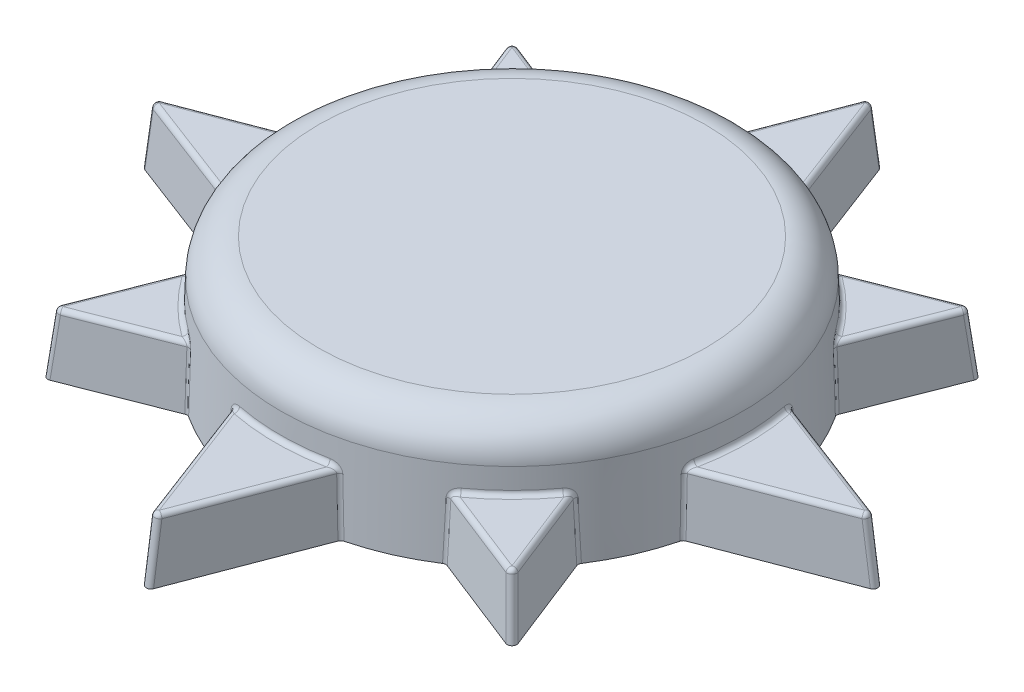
SolidWorks part; units mm, degrees
ref_plane "Front Plane" through (0, 0, 0) normal (0, 0, 1) x (1, 0, 0)
ref_plane "Top Plane" through (0, 0, 0) normal (0, 1, 0) x (1, 0, 0)
ref_plane "Right Plane" through (0, 0, 0) normal (1, 0, 0) x (0, 0, -1)
sketch "Sketch1" plane through (0, 0, 0) normal (0, 1, 0) x (1, 0, 0)
  circle A0 centre (0, 0) radius 25
  dimension "D1" = 50
sketch "Sketch2" plane through (0, 0, 0) normal (0, 1, 0) x (1, 0, 0)
  line L0 (-6, 24.2693) -> (0, 40)
  line L1 (0, 40) -> (6, 24.2693)
  line L2 (0, 0) -> (17.6777, 17.6777) construction
  line L3 (0, 0) -> (25, 0) construction
  line L4 (13.785, 20.856) -> (25.4362, 25.4362)
  line L5 (25.4362, 25.4362) -> (20.856, 13.785)
  line L6 (17.6777, 17.6777) -> (25.4362, 25.4362) construction
  line L7 (-6, 24.2693) -> (-7.3019, 20.856)
  line L8 (-7.3019, 20.856) -> (7.3019, 20.856)
  line L9 (7.3019, 20.856) -> (6, 24.2693)
  line L10 (13.785, 20.856) -> (10.4445, 19.5429)
  line L11 (10.4445, 19.5429) -> (19.5429, 10.4445)
  line L12 (19.5429, 10.4445) -> (20.856, 13.785)
  circle A0 centre (0, 0) radius 25 construction
  circle A1 centre (0, 0) radius 25 construction
  dimension "D1" = 40
  dimension "D2" = 12
  dimension "D3" = 45
  dimension "D4" = 10
  dimension "D5" = 35.9723
extrude "Boss-Extrude1" add sketch "Sketch1" along normal blind 13 draft 2
fillet "Fillet1" radius 4 1 edges at (0, 13, 24.546)
extrude "Boss-Extrude3" add sketch "Sketch2" along normal blind 6.5 draft 3 contours L11 L12 L5 L4 L10 | L1 L9 L8 L7 L0
fillet "Fillet2" radius 0.5 12 edges at (17.5172, 6.5, -17.5172) (20.6903, 3.2516, -13.8292) (19.3529, 6.5, -22.6788) (25.1347, 3.25, -25.1347) (13.8292, 3.2516, -20.6903) (22.6788, 6.5, -19.3529) (0, 6.5, -24.773) (-5.848, 3.2516, -24.1896) (-2.8482, 6.5, -31.5767) (0, 3.25, -39.5221) (2.8482, 6.5, -31.5767) (5.848, 3.2516, -24.1896)
pattern_circular "CirPattern4" count 4 over 360 about axis through (0, 13, 0) along (0, 1, 0) of "Boss-Extrude3", "Fillet2"
